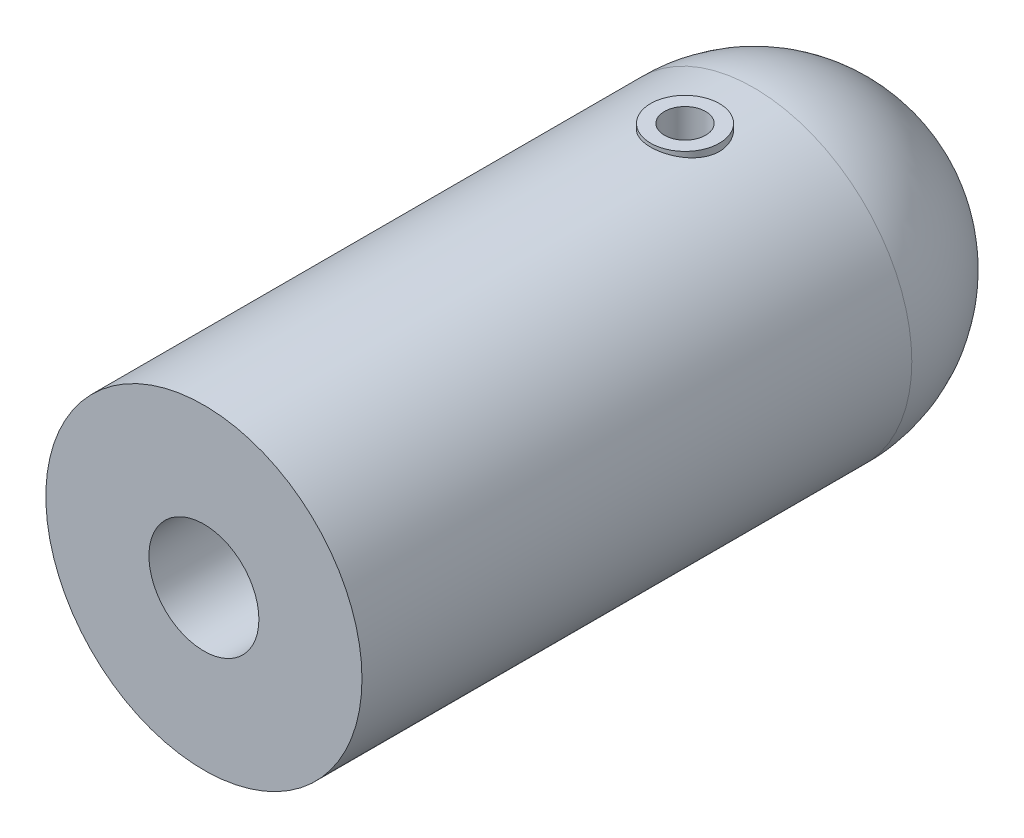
SolidWorks part; units mm, degrees
ref_plane "Plan de face" through (0, 0, 0) normal (0, 0, 1) x (1, 0, 0)
ref_plane "Plan de dessus" through (0, 0, 0) normal (0, 1, 0) x (1, 0, 0)
ref_plane "Plan de droite" through (0, 0, 0) normal (1, 0, 0) x (0, 0, -1)
sketch "Esquisse1" plane through (0, 0, 0) normal (0, 0, 1) x (1, 0, 0)
  circle A0 centre (0, 0) radius 23
  dimension "D2" = 46
extrude "Extrusion1" add sketch "Esquisse1" along normal blind 80
sketch "Esquisse3" plane through (0, 0, 80) normal (0, 0, 1) x (1, 0, 0)
  circle A0 centre (0, 0) radius 8
  dimension "D1" = 16
extrude "Enlèv. mat.-Extru.1" cut sketch "Esquisse3" against normal blind 90
ref_plane "Plan1" through (0, 23.5, 0) normal (0, 1, 0) x (-1, 0, 0)
ref_plane "Plan2" through (0, -23.5, 0) normal (0, 1, 0) x (-1, 0, 0)
sketch "Esquisse4" plane through (0, 23.5, 0) normal (0, 1, 0) x (-1, 0, 0)
  circle A0 centre (0, 10) radius 5
  dimension "D1" = 10
  dimension "D2" = 10
extrude "Extrusion2" add sketch "Esquisse4" against normal up to next
sketch "Esquisse5" plane through (0, -23.5, 0) normal (0, 1, 0) x (-1, 0, 0)
  circle A0 centre (0, 10) radius 5
extrude "Extrusion3" add sketch "Esquisse5" along normal up to next
sketch "Esquisse7" plane through (0, -23.5, 0) normal (0, -1, 0) x (1, 0, 0)
  circle A0 centre (0, 10) radius 3
  dimension "D1" = 6
extrude "Enlèv. mat.-Extru.4" cut sketch "Esquisse7" against normal blind 10
sketch "Esquisse8" plane through (0, 23.5, 0) normal (0, 1, 0) x (-1, 0, 0)
  circle A0 centre (0, 10) radius 3
  dimension "D1" = 6
extrude "Enlèv. mat.-Extru.5" cut sketch "Esquisse8" against normal blind 10
sketch "Esquisse9" plane through (0, 0, 0) normal (0, 1, 0) x (1, 0, 0)
  line L0 (0, -2.0305) -> (0, 31.7953) construction
  line L1 (-23, 0) -> (0, 0)
  line L2 (23, 0) -> (-23, 0) construction
  line L3 (0, 0) -> (0, 23.1697)
  arc A0 (-23, 0) -> (0, 23.1697) centre (0.0849, 0.0849) cw
revolve "Révolution2" add sketch "Esquisse9" angle 360 about L3
